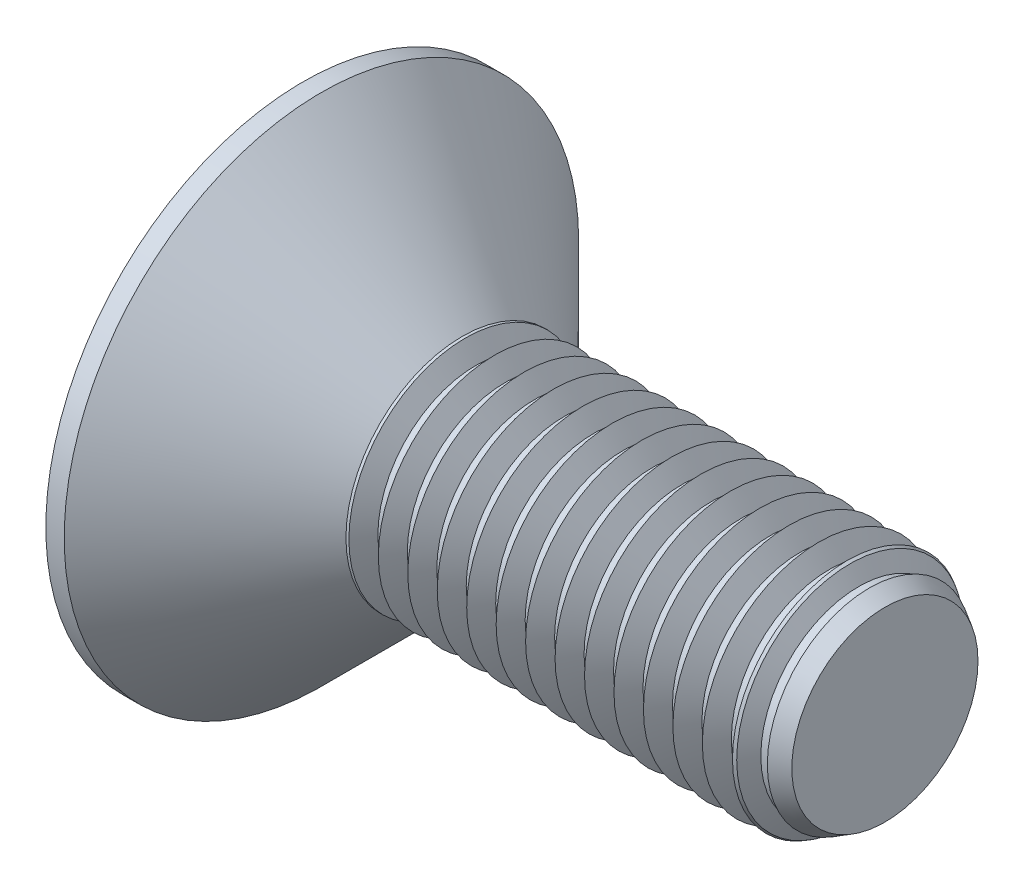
SolidWorks part; units mm, degrees
ref_plane "Front" through (0, 0, 0) normal (0, 0, 1) x (1, 0, 0)
ref_plane "Top" through (0, 0, 0) normal (0, 1, 0) x (1, 0, 0)
ref_plane "Right" through (0, 0, 0) normal (1, 0, 0) x (0, 0, -1)
other "Configuration Table"
sketch "Sketch1" plane through (0, 0, 0) normal (0, 0, 1) x (1, 0, 0)
  line L0 (0, 4.2) -> (0.3, 4.2)
  line L1 (0.3, 4.2) -> (2.6, 1.9)
  line L2 (2.6, 1.9) -> (9.5, 1.9)
  line L3 (9.5, 1.9) -> (9.5, 0)
  line L4 (9.5, 0) -> (0, 0)
  line L5 (0, 0) -> (0, 4.2)
  line L6 (6.6207, 0) -> (-0.9387, 0) construction
revolve "Revolve1" add sketch "Sketch1" angle 360 about L6
chamfer "Chamfer1" distance 0.38 angle 60 1 edges at (9.5, 0, -1.9)
sketch "Sketch9" plane through (0, 0, 0) normal (0, 0, 1) x (1, 0, 0)
  line L0 (2.9558, 1.6) -> (2.8213, 1.6)
  line L1 (2.8213, 1.6) -> (2.6481, 1.9)
  line L2 (2.9558, 1.6) -> (3.129, 1.9)
  line L3 (2.6481, 1.9) -> (2.6481, 2.15)
  line L4 (3.129, 1.9) -> (3.129, 2.15)
  line L5 (2.6481, 2.15) -> (3.129, 2.15)
  line L6 (2.8886, 1.6) -> (2.8886, 0) construction
  line L7 (0, 0) -> (7.3035, 0) construction
  line L8 (2.6, 1.9) -> (2.6, -1.9) construction
  line L9 (8.8418, 1.9) -> (2.6, 1.9) construction
revolve "ThreadSchematic" cut sketch "Sketch9" angle 360 about L7
pattern_linear "ThdSchPat" count 15 spacing 0.4809 along (1, 0, 0) of "ThreadSchematic"
sketch "Sketch3" plane through (0, 0, 0) normal (0, 0, 1) x (1, 0, 0)
  line L0 (2.6, 1.9) -> (9.5, 1.9) construction
  line L2 (7.5, 1.9) -> (8, 1.9) construction
  line L3 (9.5, 1.9) -> (9.5, 0) construction
  line L4 (8, 1.9) -> (9.5, 1.9)
  line L5 (2.9, 0) -> (5.4301, 0) construction
  line L6 (9.5, 0) -> (9.7, 0)
  line L7 (9.7, 0) -> (9.7, 1.9)
  line L8 (9.7, 1.9) -> (9.5, 1.9)
  line L9 (8, 1.9) -> (9.5, 0)
revolve "EndCone" [suppressed] cut sketch "Sketch3" angle 360 about L5
sketch "Sketch4" plane through (0, 0, 0) normal (-1, 0, 0) x (0, 0, 1)
  line L0 (-0.25, 1) -> (-0.25, 0.25)
  line L1 (-0.25, 1) -> (0.25, 1)
  line L2 (-1, 0.25) -> (-1, -0.25)
  line L3 (-0.25, -1) -> (0.25, -1)
  line L4 (1, 0.25) -> (1, -0.25)
  line L5 (0.25, 1) -> (0.25, 0.25)
  line L6 (0.25, 0.25) -> (1, 0.25)
  line L7 (0.25, -0.25) -> (1, -0.25)
  line L8 (0.25, -0.25) -> (0.25, -1)
  line L9 (-0.25, -0.25) -> (-0.25, -1)
  line L10 (-0.25, -0.25) -> (-1, -0.25)
  line L11 (-0.25, 0.25) -> (-1, 0.25)
  line L12 (1, 0) -> (-1, 0) construction
extrude "Cut-Extrude1" cut sketch "Sketch4" against normal blind 1.2
draft "Draft1" type of draft neutral plane draft angle 35 faces to draft 4 parameters "D1"=35
draft "Draft2" type of draft neutral plane draft angle 8 faces to draft 8 parameters "D1"=8
sketch "Sketch6" plane through (1.2, 0, 0) normal (-1, 0, 0) x (0, 0, 1)
  line L0 (0.0814, 0.0814) -> (0.0814, 0.1598) construction
  line L1 (0.1598, 0.0814) -> (0.0814, 0.0814) construction
  line L2 (-0.0814, 0.1598) -> (-0.0814, 0.0814) construction
  line L3 (-0.0814, 0.0814) -> (-0.1598, 0.0814) construction
  line L4 (-0.1598, -0.0814) -> (-0.0814, -0.0814) construction
  line L5 (-0.0814, -0.0814) -> (-0.0814, -0.1598) construction
  line L6 (0.0814, -0.1598) -> (0.0814, -0.0814) construction
  line L7 (0.0814, -0.0814) -> (0.1598, -0.0814) construction
  line L9 (-0.1206, 0.0814) -> (-0.1206, -0.0814)
  line L10 (-0.0814, -0.1206) -> (0.0814, -0.1206)
  line L11 (0.1206, -0.0814) -> (0.1206, 0.0814)
  line L12 (0.0814, 0.1206) -> (-0.0814, 0.1206)
  arc A0 (0.0814, 0.1206) -> (0.1206, 0.0814) centre (0.1206, 0.1206) ccw
  arc A1 (-0.0814, 0.1206) -> (-0.1206, 0.0814) centre (-0.1206, 0.1206) cw
  arc A2 (-0.1206, -0.0814) -> (-0.0814, -0.1206) centre (-0.1206, -0.1206) cw
  arc A3 (0.0814, -0.1206) -> (0.1206, -0.0814) centre (0.1206, -0.1206) cw
sketch "Sketch7" plane through (0, 0, 0) normal (-1, 0, 0) x (0, 0, 1)
  line L8 (0.25, 0.25) -> (0.25, 1) construction
  line L9 (1, 0.25) -> (0.25, 0.25) construction
  line L10 (0.25, -0.25) -> (1, -0.25) construction
  line L11 (0.25, -1) -> (0.25, -0.25) construction
  line L12 (-0.25, 1) -> (-0.25, 0.25) construction
  line L13 (-0.25, 0.25) -> (-1, 0.25) construction
  line L14 (-1, -0.25) -> (-0.25, -0.25) construction
  line L15 (-0.25, -0.25) -> (-0.25, -1) construction
  line L16 (0.2892, 0.25) -> (0.2892, -0.25)
  line L17 (0.25, -0.2892) -> (-0.25, -0.2892)
  line L18 (-0.2892, -0.25) -> (-0.2892, 0.25)
  line L19 (-0.25, 0.2892) -> (0.25, 0.2892)
  arc A0 (0.25, 0.2892) -> (0.2892, 0.25) centre (0.2892, 0.2892) ccw
  arc A1 (-0.25, 0.2892) -> (-0.2892, 0.25) centre (-0.2892, 0.2892) cw
  arc A2 (-0.2892, -0.25) -> (-0.25, -0.2892) centre (-0.2892, -0.2892) cw
  arc A3 (0.0814, 0.1206) -> (0.1206, 0.0814) centre (0.1206, 0.1206) ccw construction
  arc A4 (0.2892, -0.25) -> (0.25, -0.2892) centre (0.2892, -0.2892) ccw
loft "Cut-Loft1" cut profiles "Sketch6", "Sketch7"
sketch "Sketch8" plane through (0, 0, 0) normal (-1, 0, 0) x (0, 0, 1)
  line L0 (0, 0) -> (1, 1) construction
  line L1 (0.0814, 0.1206) -> (1, 1)
  line L2 (1, 1) -> (0.1206, 0.0814)
  line L3 (0.25, 1) -> (1, 1) construction
  line L4 (1, 1) -> (1, 0.25) construction
  line L5 (0, 0) -> (0.1206, 0) construction
  line L6 (0.1206, 0.0814) -> (0.1206, 0)
  line L7 (0.0814, 0.1206) -> (0, 0.1206)
  line L8 (0, 0.1206) -> (0, 0) construction
  line L9 (0.0814, -0.1206) -> (0, -0.1206)
  line L10 (1, -1) -> (0.0814, -0.1206)
  line L11 (0.1206, -0.0814) -> (1, -1)
  line L12 (0.1206, -0.0814) -> (0.1206, 0)
  line L13 (-0.1206, -0.0814) -> (-0.1206, 0)
  line L14 (-1, -1) -> (-0.1206, -0.0814)
  line L15 (-0.0814, -0.1206) -> (-1, -1)
  line L16 (-0.0814, -0.1206) -> (0, -0.1206)
  line L17 (-0.0814, 0.1206) -> (0, 0.1206)
  line L18 (-1, 1) -> (-0.0814, 0.1206)
  line L19 (-0.1206, 0.0814) -> (-1, 1)
  line L20 (-0.1206, 0.0814) -> (-0.1206, 0)
  arc A1 (0.0814, 0.1206) -> (0.1206, 0.0814) centre (0.1206, 0.1206) ccw construction
  arc A2 (0.0814, 0.1206) -> (0.1206, 0.0814) centre (0.1206, 0.1206) ccw construction
extrude "TypeZ" [suppressed] cut sketch "Sketch8" against normal blind 0.24 draft 3
equation "\"D1@Chamfer1\" = \"d@Sketch1\" / 10"
equation "\"D1@Sketch4\" = \"m@Sketch4\" / 4"
equation "\"D1@TypeZ\" = \"p@Cut-Extrude1\"*0.2"
equation "\"D1@Sketch3\" = \"y@Sketch3\" / 4"
equation "\"threadstart@Sketch9\"=\"advance@Sketch9\"*0.6"
equation "\"D1@ThdSchPat\" = int(((\"l@Sketch1\"-\"k@Sketch1\")/\"advance@Sketch9\") + 0.999)"
equation "\"D3@ThdSchPat\" = \"advance@Sketch9\""
equation "\"minordia@Sketch9\" = \"D2@ThreadCosmetic\""
